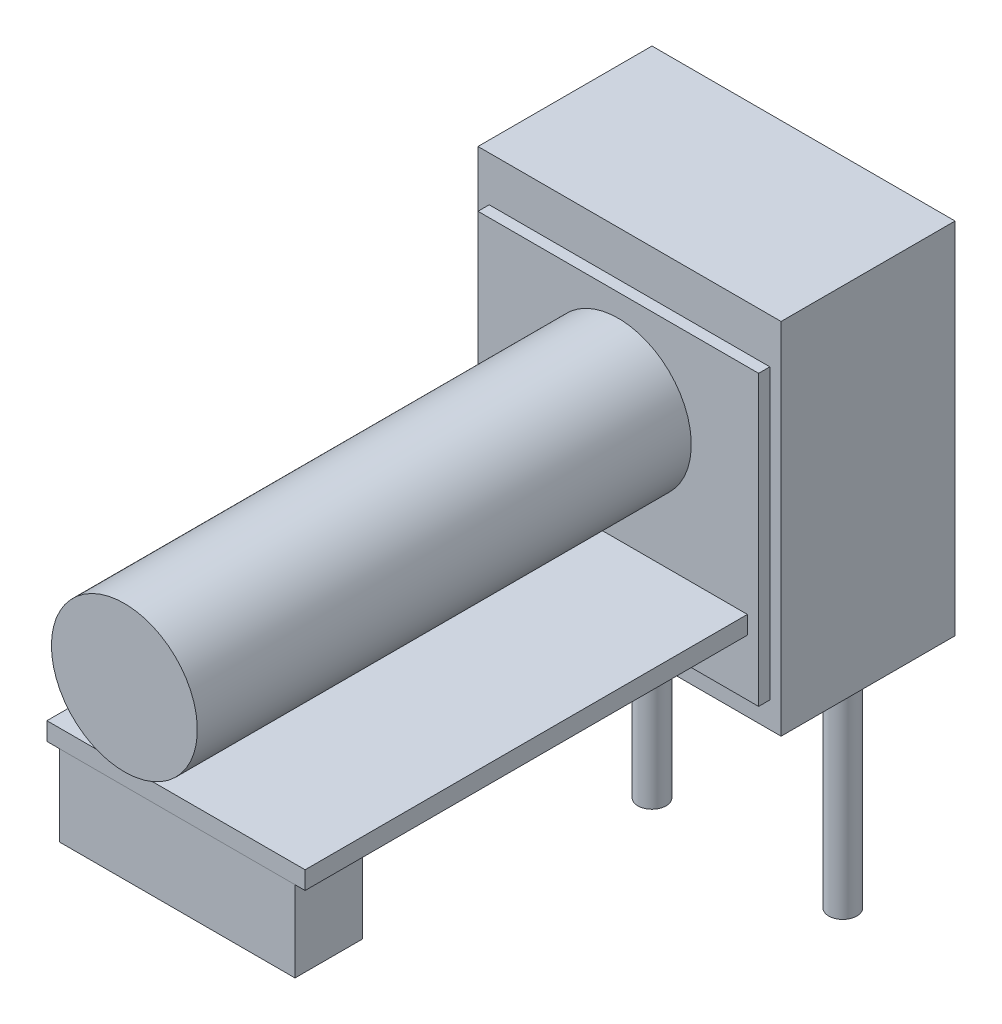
SolidWorks part; units mm, degrees
ref_plane "Front" through (0, 0, 0) normal (0, 0, 1) x (1, 0, 0)
ref_plane "Top" through (0, 0, 0) normal (0, 1, 0) x (1, 0, 0)
ref_plane "Right" through (0, 0, 0) normal (1, 0, 0) x (0, 0, -1)
sketch "Sketch1" plane through (0, 0, 0) normal (0, 0, 1) x (1, 0, 0)
  line L1 (28.2828, 35.5711) -> (55.2828, 35.5711)
  line L2 (28.2828, 35.5711) -> (28.2828, 3.5711)
  line L3 (28.2828, 3.5711) -> (55.2828, 3.5711)
  line L4 (55.2828, 35.5711) -> (55.2828, 3.5711)
  dimension "D1" = 27
  dimension "D2" = 32
extrude "Extrude1" add sketch "Sketch1" along normal blind 15.5
sketch "Sketch2" plane through (0, 0, 15.5) normal (0, 0, 1) x (1, 0, 0)
  line L3 (55.2828, 3.5711) -> (55.2828, 35.5711) construction
  line L4 (55.2828, 35.5711) -> (28.2828, 35.5711) construction
  circle A0 centre (41.7828, 23.0711) radius 6.5
  dimension "D1" = 13.5
  dimension "D2" = 12.5
extrude "Extrude2" add sketch "Sketch2" along normal blind 45
sketch "Sketch3" plane through (0, 0, 15.5) normal (0, 0, 1) x (1, 0, 0)
  line L0 (55.2828, 35.5711) -> (28.2828, 35.5711) construction
  line L1 (29.2828, 31.5711) -> (54.2828, 31.5711)
  line L2 (29.2828, 31.5711) -> (29.2828, 5.8711)
  line L3 (29.2828, 5.8711) -> (54.2828, 5.8711)
  line L4 (54.2828, 31.5711) -> (54.2828, 5.8711)
  line L5 (55.2828, 3.5711) -> (55.2828, 35.5711) construction
  line L6 (28.2828, 35.5711) -> (28.2828, 3.5711) construction
  line L7 (28.2828, 3.5711) -> (55.2828, 3.5711) construction
  dimension "D1" = 4
  dimension "D2" = 1
  dimension "D3" = 1
  dimension "D4" = 2.3
extrude "Extrude3" add sketch "Sketch3" along normal blind 1
sketch "Sketch4" plane through (0, 0, 16.5) normal (0, 0, 1) x (1, 0, 0)
  line L0 (29.2828, 5.8711) -> (54.2828, 5.8711) construction
  line L1 (30.2828, 10.8711) -> (53.2828, 10.8711)
  line L2 (30.2828, 10.8711) -> (30.2828, 12.4711)
  line L3 (30.2828, 12.4711) -> (53.2828, 12.4711)
  line L4 (53.2828, 10.8711) -> (53.2828, 12.4711)
  line L5 (54.2828, 5.8711) -> (54.2828, 31.5711) construction
  line L6 (29.2828, 31.5711) -> (29.2828, 5.8711) construction
  dimension "D1" = 5
  dimension "D2" = 1
  dimension "D3" = 1
  dimension "D4" = 1.6
extrude "Extrude4" add sketch "Sketch4" along normal blind 39.4
sketch "Sketch5" plane through (0, 10.8711, 0) normal (0, -1, 0) x (1, 0, 0)
  line L0 (30.2828, 55.9) -> (30.2828, 16.5) construction
  line L1 (31.2828, 55.8) -> (52.2828, 55.8)
  line L2 (31.2828, 55.8) -> (31.2828, 49.8)
  line L3 (31.2828, 49.8) -> (52.2828, 49.8)
  line L4 (52.2828, 55.8) -> (52.2828, 49.8)
  line L5 (53.2828, 55.9) -> (53.2828, 16.5) construction
  line L7 (30.2828, 55.9) -> (53.2828, 55.9) construction
  dimension "D1" = 6
  dimension "D2" = 1
  dimension "D3" = 1
  dimension "D4" = 0.1
extrude "Extrude5" add sketch "Sketch5" along normal blind 7.3
sketch "Sketch7" plane through (0, 0, 0) normal (0, 0, -1) x (-1, 0, 0)
  line L0 (-28.2828, 35.5711) -> (-28.2828, 3.5711) construction
  line L2 (-52.2828, 16.7616) -> (-52.2828, 4.5862)
  line L3 (-52.2828, 4.5862) -> (-31.2828, 4.5862)
  line L4 (-31.2828, 16.7616) -> (-31.2828, 4.5862)
  line L5 (-55.2828, 3.5711) -> (-55.2828, 35.5711) construction
  line L6 (-28.2828, 3.5711) -> (-55.2828, 3.5711) construction
  arc A0 (-31.2828, 16.7616) -> (-52.2828, 16.7616) centre (-41.7828, 22.5711) ccw
  dimension "D1" = 3
  dimension "D3" = 3
  dimension "D4" = 19
  dimension "D5" = 13.5
extrude "Cut-Extrude2" cut sketch "Sketch7" against normal blind 10
sketch "Sketch8" plane through (0, 3.5711, 0) normal (0, -1, 0) x (1, 0, 0)
  line L0 (28.2828, 15.5) -> (28.2828, 0) construction
  line L1 (35.2828, 0) -> (31.2828, 0)
  line L2 (35.2828, 0) -> (35.2828, 3.8642)
  line L3 (33.2828, 0) -> (33.2828, 10) construction
  line L4 (31.2828, 0) -> (31.2828, 3.8642)
  line L5 (52.2828, 0) -> (48.2828, 0)
  line L6 (52.2828, 0) -> (52.2828, 3.8642)
  line L7 (50.2828, 0) -> (50.2828, 10) construction
  line L8 (48.2828, 0) -> (48.2828, 3.8642)
  line L9 (55.2828, 15.5) -> (55.2828, 0) construction
  line L11 (28.2828, 0) -> (55.2828, 0) construction
  line L12 (48.2828, 6.1358) -> (48.2828, 8)
  line L13 (52.2828, 6.1358) -> (52.2828, 8)
  line L14 (31.2828, 6.1358) -> (31.2828, 8)
  line L15 (35.2828, 6.1358) -> (35.2828, 8)
  arc A0 (52.2828, 8) -> (48.2828, 8) centre (50.2828, 8) ccw
  arc A1 (35.2828, 8) -> (31.2828, 8) centre (33.2828, 8) ccw
  arc A2 (35.2828, 3.8642) -> (35.2828, 6.1358) centre (33.2828, 5) ccw
  arc A3 (52.2828, 3.8642) -> (52.2828, 6.1358) centre (50.2828, 5) ccw
  arc A4 (48.2828, 6.1358) -> (48.2828, 3.8642) centre (50.2828, 5) ccw
  arc A5 (31.2828, 6.1358) -> (31.2828, 3.8642) centre (33.2828, 5) ccw
  dimension "D1" = 3
  dimension "D2" = 3
  dimension "D3" = 4
  dimension "D4" = 4
  dimension "D5" = 8
  dimension "D6" = 8
extrude "Cut-Extrude3" cut sketch "Sketch8" against normal blind 2
sketch "Sketch9" plane through (0, 0, 10) normal (0, 0, -1) x (-1, 0, 0)
  line L1 (-33.6905, 28.2514) -> (-42.656, 32.4194)
  line L2 (-42.656, 32.4194) -> (-50.7483, 26.739)
  line L3 (-50.7483, 26.739) -> (-49.8751, 16.8907)
  line L4 (-49.8751, 16.8907) -> (-40.9096, 12.7228)
  line L5 (-40.9096, 12.7228) -> (-32.8173, 18.4031)
  line L6 (-32.8173, 18.4031) -> (-33.6905, 28.2514)
  circle A0 centre (-41.7828, 22.5711) radius 8.5623 construction
extrude "Extrude6" add sketch "Sketch9" along normal blind 10
sketch "Sketch10" plane through (0, 3.5711, 0) normal (0, -1, 0) x (1, 0, 0)
  circle A0 centre (33.2828, 5) radius 2.3
  circle A1 centre (50.2828, 5) radius 2.3
extrude "Extrude7" add sketch "Sketch10" against normal blind 2
sketch "Sketch11" plane through (0, 3.5711, 0) normal (0, -1, 0) x (1, 0, 0)
  circle A0 centre (33.2828, 5) radius 3.2
  circle A1 centre (50.2828, 5) radius 3.2
extrude "Extrude8" add sketch "Sketch11" along normal blind 1
sketch "Sketch12" plane through (0, 2.5711, 0) normal (0, -1, 0) x (1, 0, 0)
  circle A0 centre (33.2828, 5) radius 1.25
  circle A1 centre (50.2828, 5) radius 1.25
extrude "Extrude9" add sketch "Sketch12" along normal blind 20
sketch "Sketch13" plane through (0, -17.4289, 0) normal (0, -1, 0) x (1, 0, 0)
  circle A0 centre (33.2828, 5) radius 0.9
  circle A1 centre (50.2828, 5) radius 0.9
extrude "Cut-Extrude4" cut sketch "Sketch13" against normal blind 20
